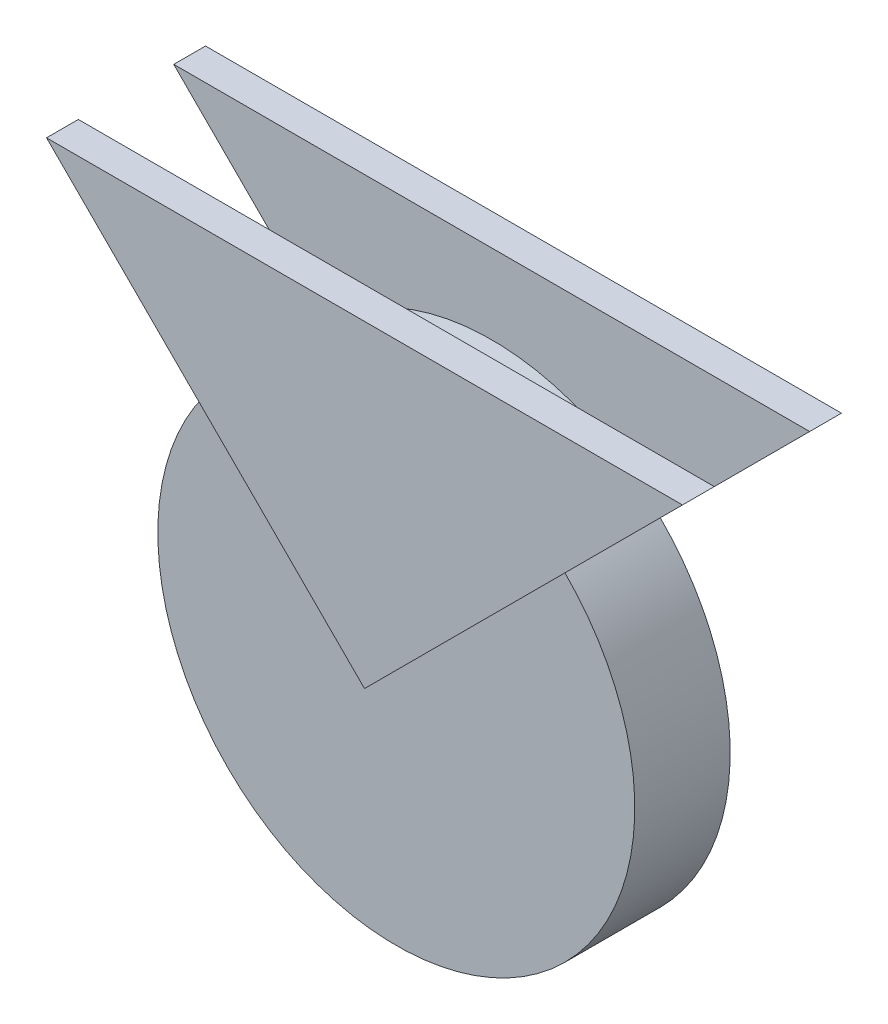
SolidWorks part; units mm, degrees
ref_plane "Front Plane" through (0, 0, 0) normal (0, 0, 1) x (1, 0, 0)
ref_plane "Top Plane" through (0, 0, 0) normal (0, 1, 0) x (1, 0, 0)
ref_plane "Right Plane" through (0, 0, 0) normal (1, 0, 0) x (0, 0, -1)
sketch "Sketch1" plane through (0, 0, 0) normal (0, 0, 1) x (1, 0, 0)
  circle A0 centre (0, 0) radius 75
  dimension "D1" = 150
extrude "Boss-Extrude1" add sketch "Sketch1" along normal blind 30
sketch "Sketch2" plane through (0, 0, 30) normal (0, 0, 1) x (1, 0, 0)
  line L0 (0, 0) -> (-100, 100)
  line L1 (-100, 100) -> (100, 100)
  line L2 (0, 100) -> (0, 0) construction
  line L3 (0, 0) -> (100, 100)
  point P4 (0, 0)
  dimension "D1" = 100
  dimension "D2" = 200
extrude "Boss-Extrude2" add sketch "Sketch2" along normal blind 10 contours L1 L3 L0
ref_plane "Plane2" through (0, 0, 15) normal (0, 0, -1) x (-1, 0, 0)
mirror "Mirror1" about plane through (0, 0, 15) normal (0, 0, -1) of "Boss-Extrude2"
